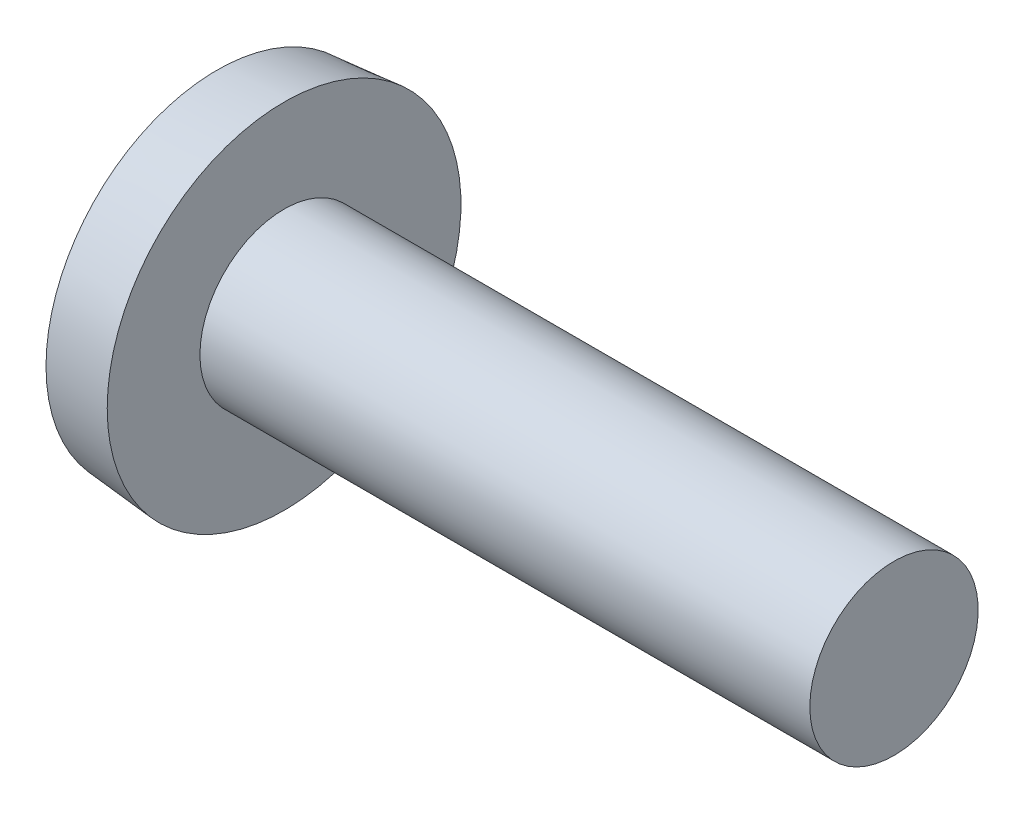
SolidWorks part; units mm, degrees
ref_plane "Plane1" through (0, 0, 0) normal (0, 0, 1) x (1, 0, 0)
ref_plane "Plane2" through (0, 0, 0) normal (0, 1, 0) x (1, 0, 0)
ref_plane "Plane3" through (0, 0, 0) normal (1, 0, 0) x (0, 0, -1)
revolve "Base-Revolve" add sketch "BodySke" angle 360 about L2
sketch "BodySke" plane through (0, 0, 0) normal (0, 0, 1) x (1, 0, 0)
  line L0 (2.2098, 1.7526) -> (2.2098, 3.683)
  line L1 (2.2098, 3.683) -> (0.8128, 3.5608)
  line L2 (-25.4, 0) -> (127, 0) construction
  line L3 (2.2098, -3.683) -> (0.8128, -3.5608) construction
  line L4 (2.2098, 1.7526) -> (14.9098, 1.7526)
  line L5 (14.9098, 1.7526) -> (14.9098, 0)
  line L6 (14.9098, 0) -> (0, 0)
  line L7 (2.2098, -1.7526) -> (14.9098, -1.7526) construction
  line L8 (3.0023, 6.35) -> (3.0023, -3.175) construction
  line L9 (2.2098, 6.35) -> (2.2098, -3.175) construction
  arc A0 (0, 0) -> (0.8128, 3.5608) centre (8.2061, 0) cw
  dimension "Head_ang" = 85
  dimension "Oval_ht" = 0.8128
  dimension "Head_ht" = 2.2098
  dimension "Diameter" = 3.5052
  dimension "Length" = 12.7
  dimension "Head_dia" = 7.366
  dimension "Advance" = 0.7925
  dimension "Thread_nom" = 12.7
sketch "Sketch2" plane through (0, 0, 0) normal (1, 0, 0) x (0, 0, -1)
  line L0 (3.683, -0.6096) -> (3.683, 0.6096)
  line L1 (3.683, 0.6096) -> (-3.683, 0.6096)
  line L2 (-3.683, 0.6096) -> (-3.683, -0.6096)
  line L3 (-3.683, -0.6096) -> (3.683, -0.6096)
  dimension "D1" = 7.366
  dimension "D2" = 3.683
  dimension "D3" = 0.6096
  dimension "Slot_width" = 1.2192
extrude "Slot" cut sketch "Sketch2" along normal blind 1.3462
sketch "Sketch3" plane through (0, 0, 0) normal (1, 0, 0) x (0, 0, -1)
  line L0 (-0.4953, 2.413) -> (0.4953, 2.413)
  line L1 (0.4953, 2.413) -> (0.4953, -2.413)
  line L2 (0.4953, -2.413) -> (-0.4953, -2.413)
  line L3 (-0.4953, -2.413) -> (-0.4953, 2.413)
  dimension "D1" = 0.4953
  dimension "Cross_width" = 0.9906
  dimension "D2" = 2.413
  dimension "Cross_dia" = 4.826
ref_plane "Plane4" through (2.794, 0, 0) normal (1, 0, 0) x (0, 0, -1)
sketch "Sketch4" plane through (2.794, 0, 0) normal (1, 0, 0) x (0, 0, -1)
  line L0 (-0.2476, 0.2476) -> (0.2476, 0.2476)
  line L1 (0.2476, 0.2476) -> (0.2477, -0.2476)
  line L2 (0.2477, -0.2476) -> (-0.2477, -0.2477)
  line L3 (-0.2477, -0.2477) -> (-0.2476, 0.2476)
  dimension "D1" = 0.4953
  dimension "D2" = 0.2476
  dimension "D3" = 0.4953
  dimension "D4" = 0.2476
loft "Cross" cut profiles "Sketch3", "Sketch4"
pattern_circular "CirPattern1" count 2 every 90 about axis through (0, 0, 0) along (1, 0, 0) of "Cross"
sketch "ThdSchSke" plane through (0, 0, 0) normal (0, 0, 1) x (1, 0, 0)
  line L0 (3.0023, -1.2802) -> (2.6715, -1.7526)
  line L1 (3.0023, -1.2802) -> (3.3331, -1.7526)
  line L2 (3.3331, -1.7526) -> (3.3331, -2.1907)
  line L3 (-3.175, 0) -> (5.1513, 0) construction
  line L5 (3.3331, -2.1907) -> (2.6715, -2.1908)
  line L6 (2.6715, -2.1908) -> (2.6715, -1.7526)
  dimension "Thread_minor" = 2.5603
  dimension "Diameter" = 3.5052
  dimension "Start" = 3.0023
  dimension "SideAngle" = 55
  dimension "VeeAngle" = 70
  dimension "Overcut" = 4.3815
revolve "ThreadSchematic" cut sketch "ThdSchSke" angle 360 about L3
pattern_linear "ThdSchPat"
equation "\"D1@Sketch3\" = \"Cross_width@Sketch3\" / 2"
equation "\"D2@Sketch3\" = \"Cross_dia@Sketch3\" / 2"
equation "\"D1@Sketch4\" = \"Cross_width@Sketch3\"*.5"
equation "\"D2@Sketch4\" = \"D1@Sketch4\" / 2"
equation "\"D3@Sketch4\" = \"D1@Sketch4\""
equation "\"D4@Sketch4\" = \"D2@Sketch4\""
equation "\"D1@Sketch2\" = \"Head_dia@BodySke\""
equation "\"D2@Sketch2\" = \"D1@Sketch2\" / 2"
equation "\"D3@Sketch2\" = \"Slot_width@Sketch2\" / 2"
equation "\"Thread_length@ThreadCosmetic\" = ((sgn( (\"Length@BodySke\" - \"Advance@BodySke\" ) - \"Thread_nom@BodySke\" )-1)*( (\"Length@BodySke\" - \"Advance@BodySke\" ) - \"Thread_nom@BodySke\" ))/-2+ \"Thread_nom@BodySke\""
equation "\"Thread_minor@ThdSchSke\" = \"Thread_minor@ThreadCosmetic\""
equation "\"Diameter@ThdSchSke\" = \"Diameter@BodySke\""
equation "\"Overcut@ThdSchSke\" = \"Diameter@BodySke\" * 1.25"
equation "\"Start@ThdSchSke\" = \"Head_ht@BodySke\" + \"Length@BodySke\" - \"Thread_length@ThreadCosmetic\"  '---Non-countersunk---"
equation "\"Num_threads@ThdSchPat\" = int( \"Thread_length@ThreadCosmetic\" / \"Advance@BodySke\" + 0.999 )  + 1"
equation "\"Advance@ThdSchPat\" = \"Thread_length@ThreadCosmetic\" /  (\"Num_threads@ThdSchPat\" - 1) 'relax it"
